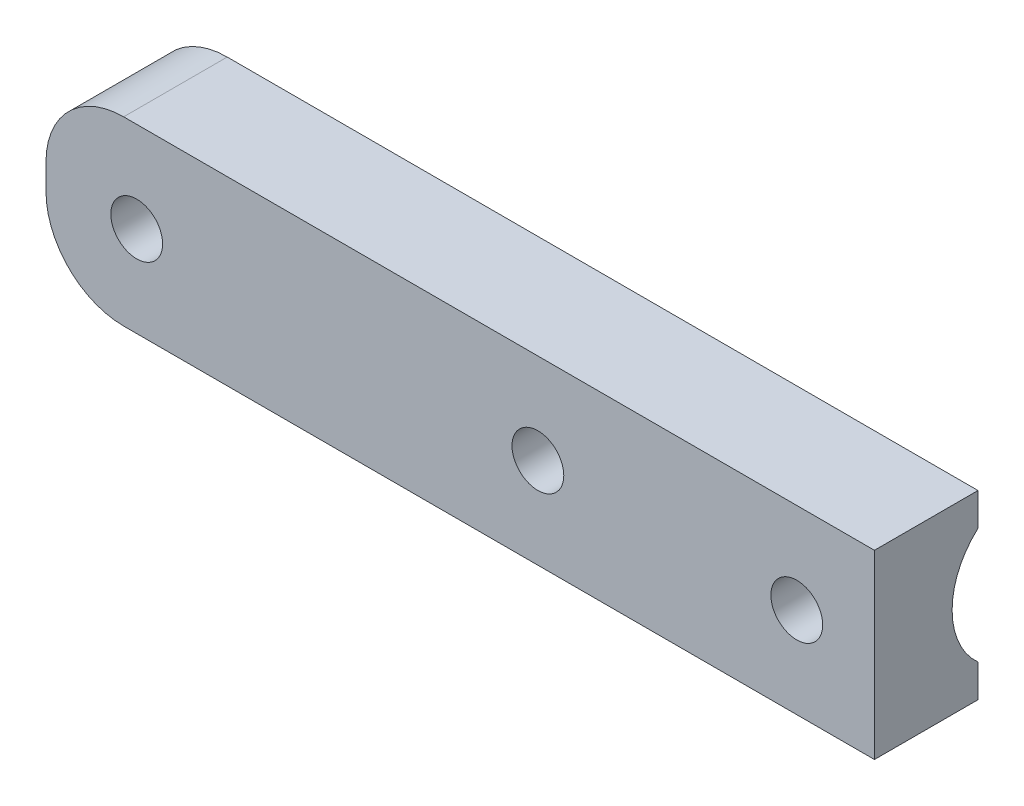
SolidWorks part; units mm, degrees
ref_plane "Front Plane" through (0, 0, 0) normal (0, 0, 1) x (1, 0, 0)
ref_plane "Top Plane" through (0, 0, 0) normal (0, 1, 0) x (1, 0, 0)
ref_plane "Right Plane" through (0, 0, 0) normal (1, 0, 0) x (0, 0, -1)
sketch "Sketch1" plane through (0, 0, 0) normal (0, 0, 1) x (1, 0, 0)
  line L0 (0, 0) -> (90.4748, 0) construction
  line L1 (-11.1252, -11.1125) -> (90.4748, -11.1125)
  line L2 (90.4748, -11.1125) -> (90.4748, 11.1125)
  line L3 (90.4748, 11.1125) -> (-11.1252, 11.1125)
  line L4 (-11.1252, 11.1125) -> (-11.1252, -11.1125)
  circle A0 centre (0, 0) radius 3.175
  circle A1 centre (80.9498, 0) radius 3.175
  circle A2 centre (49.1998, 0) radius 3.175
  dimension "D4" = 6.35
  dimension "D5" = 6.35
  dimension "D1" = 11.1252
  dimension "D2" = 22.225
  dimension "D3" = 101.6
  dimension "D6" = 31.75
  dimension "D7" = 9.525
extrude "Boss-Extrude1" add sketch "Sketch1" along normal mid plane 12.7
fillet "Fillet1" radius 9.525 2 edges at (-11.1252, -11.1125, 0) (-11.1252, 11.1125, 0)
sketch "Sketch2" plane through (90.4748, 0, 0) normal (1, 0, 0) x (0, 0, -1)
  circle A0 centre (12.7, 0) radius 9.525
  dimension "D1" = 19.05
  dimension "D2" = 12.7
extrude "Cut-Extrude1" cut sketch "Sketch2" against normal blind 50.8
sketch "Sketch3" plane through (0, 0, 0) normal (0, 0, 1) x (1, 0, 0)
  circle A0 centre (0, 0) radius 9.525
  dimension "D1" = 19.05
extrude "Cut-Extrude2" cut sketch "Sketch3" against normal blind 50.8 from offset 2.54
sketch "Sketch4" [suppressed] plane through (0, 0, 0) normal (0, 0, 1) x (1, 0, 0)
  line L0 (0, 0) -> (0, 3.175)
  line L1 (0, 3.175) -> (-19.05, 3.175)
  line L2 (-19.05, 3.175) -> (-19.05, -3.175)
  line L3 (0, 0) -> (0, -3.175)
  line L4 (0, -3.175) -> (-19.05, -3.175)
  circle A0 centre (0, 0) radius 3.175 construction
  dimension "D1" = 19.05
extrude "Cut-Extrude3" [suppressed] cut sketch "Sketch4" against normal mid plane 25.4
